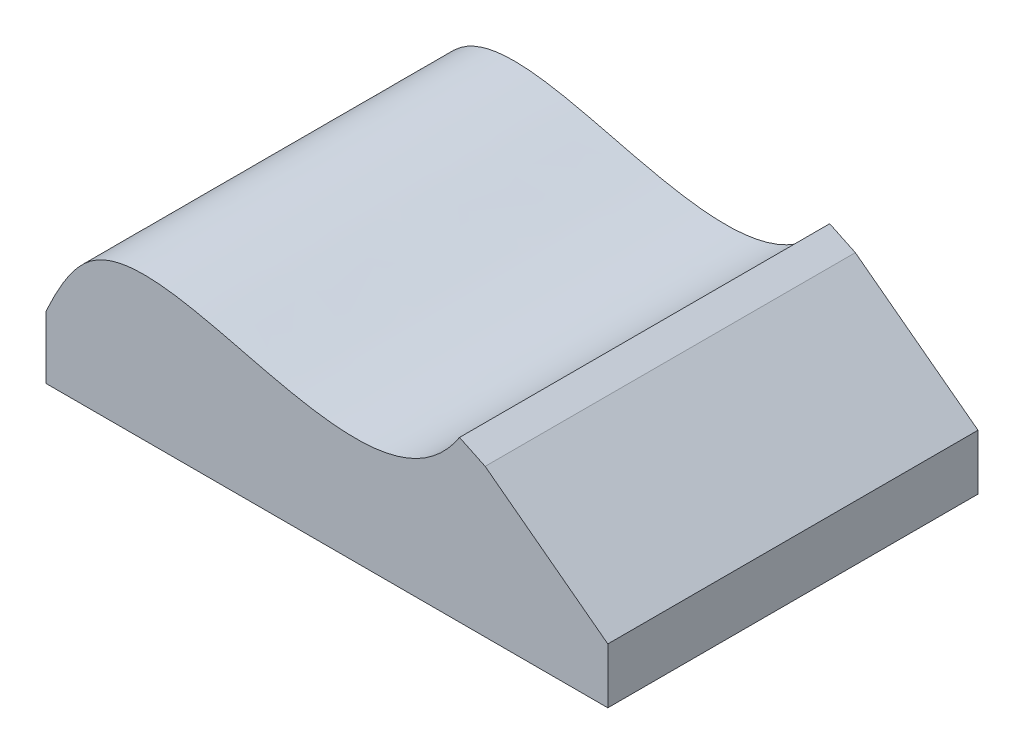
SolidWorks part; units mm, degrees
ref_plane "Front Plane" through (0, 0, 0) normal (0, 0, 1) x (1, 0, 0)
ref_plane "Top Plane" through (0, 0, 0) normal (0, 1, 0) x (1, 0, 0)
ref_plane "Right Plane" through (0, 0, 0) normal (1, 0, 0) x (0, 0, -1)
sketch "Sketch1" plane through (0, 0, 0) normal (0, 0, 1) x (1, 0, 0)
  spline S0 degree 3 poles (-93.1781, -17.1143) (-67.9074, -16.4926) (-66.3638, 72.595) (17.2953, 1.4017) (33.7544, 43.592) knots 0 0 0 0 0.404187 1 1 1 1
surface "Surface-Extrude1" sketch "Sketch1" parameters "D1"=152.4
sketch "Sketch2" plane through (0, 0, 0) normal (0, 0, 1) x (1, 0, 0)
  line L0 (-46.5712, 72.9088) -> (35.8817, 33.5173)
  line L1 (35.8817, 33.5173) -> (75.901, 3.3611)
surface "Surface-Extrude2" sketch "Sketch2" parameters "D1"=152.4
sketch "Sketch3" plane through (0, 0, 0) normal (0, 1, 0) x (1, 0, 0)
  line L1 (-63.7047, -41.9735) -> (63.7047, -41.9735)
  line L2 (-63.7047, -41.9735) -> (-63.7047, 41.9735)
  line L3 (-63.7047, 41.9735) -> (63.7047, 41.9735)
  line L4 (63.7047, -41.9735) -> (63.7047, 41.9735)
  line L5 (-63.7047, -41.9735) -> (63.7047, 41.9735) construction
  line L6 (-63.7047, 41.9735) -> (63.7047, -41.9735) construction
  point P0 (0, 0)
surface "Surface-Trim1"
surface "Surface-Trim2"
surface "Surface-Knit1"
extrude "Boss-Extrude3" add sketch "Sketch3" along normal up to surface (14.1922 mm away)
